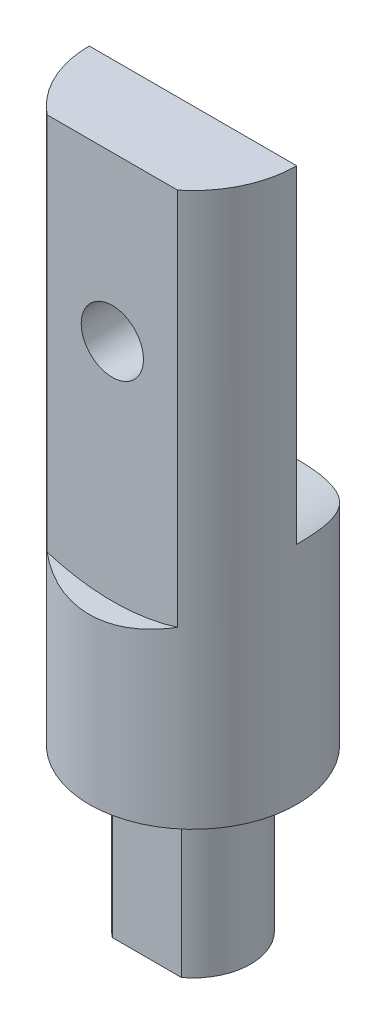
SolidWorks part; units mm, degrees
ref_plane "Front Plane" through (0, 0, 0) normal (0, 0, 1) x (1, 0, 0)
ref_plane "Top Plane" through (0, 0, 0) normal (0, 1, 0) x (1, 0, 0)
ref_plane "Right Plane" through (0, 0, 0) normal (1, 0, 0) x (0, 0, -1)
sketch "Sketch1" plane through (0, 0, 0) normal (0, 1, 0) x (1, 0, 0)
  circle A0 centre (0, 0) radius 4.5
  dimension "D1" = 9
extrude "Boss-Extrude1" add sketch "Sketch1" along normal blind 24 contours A0
sketch "Sketch2" plane through (0, 0, 0) normal (0, -1, 0) x (1, 0, 0)
  circle A0 centre (0, 0) radius 3.9
  dimension "D1" = 7.8
extrude "Boss-Extrude2" add sketch "Sketch2" along normal blind 7
sketch "Sketch4" plane through (0, 0, 0) normal (0, -1, 0) x (1, 0, 0)
  line L0 (-4.6448, 3.9) -> (4.9302, 3.9)
  line L1 (4.9302, 3.9) -> (4.9302, 6.135)
  line L2 (4.9302, 6.135) -> (-4.5584, 6.135)
  line L3 (-4.5584, 6.135) -> (-4.6448, 3.9)
  line L4 (-5.2639, -3.9) -> (5.6645, -3.9)
  line L5 (5.6645, -3.9) -> (5.6645, -4.8677)
  line L6 (5.6645, -4.8677) -> (-5.2639, -4.767)
  line L7 (-5.2639, -4.767) -> (-5.2639, -3.7879)
  circle A0 centre (0, 0) radius 3.9 construction
extrude "Cut-Extrude3" [suppressed] cut sketch "Sketch4" against normal blind 22 contours L2 L3 L0 L1 M2 | L7 L6 L5 L4 M2 | L4 M2
sketch "Sketch5" [suppressed] plane through (0, 0, 0) normal (1, 0, 0) x (0, 0, -1)
  line L0 (3.9, 21.5) -> (-3.9, 21.5) construction
  line L1 (5.8488, 18.5) -> (0.1, 18.5)
  line L2 (5.8488, 18.5) -> (5.8488, 14.5)
  line L3 (5.8488, 14.5) -> (0.1, 14.5)
  line L4 (0.1, 18.5) -> (0.1, 14.5)
  line L5 (-3.9, 21.5) -> (-3.9, 0) construction
  dimension "D1" = 3
  dimension "D2" = 4
  dimension "D3" = 4
extrude "Cut-Extrude4" [suppressed] cut sketch "Sketch5" against normal through all both and the other way through all
sketch "Sketch6" plane through (0, -7, 0) normal (0, -1, 0) x (1, 0, 0)
  circle A0 centre (0, 0) radius 2.5
  dimension "D1" = 5
sketch "Sketch7" plane through (0, -7, 0) normal (0, -1, 0) x (1, 0, 0)
  circle A0 centre (0, 0) radius 3.9
extrude "Cut-Extrude6" cut sketch "Sketch7" against normal blind 7
extrude "Boss-Extrude3" add sketch "Sketch6" against normal blind 7 contours A0
sketch "Sketch8" plane through (0, -7, 0) normal (0, -1, 0) x (1, 0, 0)
  line L1 (-3.2888, -2) -> (3.2888, -2)
  line L2 (-3.2888, -2) -> (-3.2888, 2)
  line L3 (-3.2888, 2) -> (3.2888, 2)
  line L4 (3.2888, -2) -> (3.2888, 2)
  line L5 (-3.2888, -2) -> (3.2888, 2) construction
  line L6 (-3.2888, 2) -> (3.2888, -2) construction
  line L7 (-3.5081, -2.9965) -> (3.5081, -2.9965)
  line L8 (-3.5081, -2.9965) -> (-3.5081, 2.9965)
  line L9 (-3.5081, 2.9965) -> (3.5081, 2.9965)
  line L10 (3.5081, -2.9965) -> (3.5081, 2.9965)
  line L11 (-3.5081, -2.9965) -> (3.5081, 2.9965) construction
  line L12 (-3.5081, 2.9965) -> (3.5081, -2.9965) construction
  point P0 (0, 0)
  point P6 (0, 0)
  dimension "D1" = 4
extrude "Cut-Extrude7" cut sketch "Sketch8" against normal blind 7
sketch "Sketch9" [suppressed] plane through (0, 0, -3.9) normal (0, 0, -1) x (-1, 0, 0)
  line L0 (2.245, 0) -> (-2.245, 0) construction
  circle A0 centre (0, 19) radius 1.5
  dimension "D1" = 3
  dimension "D2" = 19
extrude "Cut-Extrude8" [suppressed] cut sketch "Sketch9" against normal blind 6
sketch "Sketch10" [suppressed] plane through (0, 0, -3.9) normal (0, 0, -1) x (-1, 0, 0)
  circle A0 centre (0, 19) radius 2
  dimension "D1" = 4
extrude "Cut-Extrude13" [suppressed] cut sketch "Sketch10" against normal blind 4
sketch "Sketch11" plane through (0, 24, 0) normal (0, 1, 0) x (1, 0, 0)
  line L0 (-4.5, 0) -> (4.5, 0)
  line L1 (-2.8284, -3.5) -> (2.8284, -3.5)
  arc A0 (4.5, 0) -> (-4.5, 0) centre (0, 0) ccw
  circle A1 centre (0, 0) radius 4.5
  arc A2 (-2.8284, -3.5) -> (2.8284, -3.5) centre (0, 0) ccw
  dimension "D2" = 3.5
  dimension "D1" = 0
extrude "Cut-Extrude14" cut sketch "Sketch11" against normal blind 8
chamfer "Chamfer1" [suppressed] distance 3 angle 55
sketch "Sketch12" plane through (0, 0, 0) normal (0, 0, -1) x (-1, 0, 0)
  circle A0 centre (0, 16.9016) radius 1.35
  dimension "D1" = 2.7
extrude "Cut-Extrude15" cut sketch "Sketch12" against normal through all
sketch "Sketch13" plane through (0, 0, 0) normal (0, 0, -1) x (-1, 0, 0)
  circle A0 centre (0, 16.9016) radius 8.426
extrude "Cut-Extrude16" cut sketch "Sketch13" along normal blind 8
sketch "Sketch14" plane through (0, 0, 3.5) normal (0, 0, 1) x (1, 0, 0)
  circle A0 centre (0, 16.5915) radius 9.4513
extrude "Cut-Extrude17" cut sketch "Sketch14" along normal blind 8
sketch "Sketch15" plane through (0, 0, -2) normal (0, 0, -1) x (-1, 0, 0)
  line L0 (1.5, -7) -> (-1.5, -7) construction
  line L1 (-6.1942, -6) -> (10.0233, -6)
  line L2 (-6.1942, -6) -> (-6.1942, -8.748)
  line L3 (-6.1942, -8.748) -> (10.0233, -8.748)
  line L4 (10.0233, -6) -> (10.0233, -8.748)
  dimension "D1" = 1
extrude "Cut-Extrude18" cut sketch "Sketch15" against normal blind 10
sketch "Sketch16" plane through (0, 0, 0) normal (0, -1, 0) x (1, 0, 0)
  line L0 (-1.5, 2) -> (1.5, 2)
  line L1 (1.5, -2) -> (-1.5, -2)
  circle A0 centre (0, 0) radius 4.1
  arc A1 (-1.5, 2) -> (-1.5, -2) centre (0, 0) ccw
  arc A2 (1.5, -2) -> (1.5, 2) centre (0, 0) ccw
  dimension "D1" = 8.2
sketch "Sketch18" plane through (0, 0, 0) normal (0, -1, 0) x (1, 0, 0)
  line L1 (-6.3758, -1) -> (6.3758, -1)
  line L2 (-6.3758, -1) -> (-6.3758, 1)
  line L3 (-6.3758, 1) -> (6.3758, 1)
  line L4 (6.3758, -1) -> (6.3758, 1)
  line L5 (-6.3758, -1) -> (6.3758, 1) construction
  line L6 (-6.3758, 1) -> (6.3758, -1) construction
  line L7 (-3.3758, -1) -> (3.3758, -1)
  line L8 (-3.3758, -1) -> (-3.3758, 1)
  line L9 (-3.3758, 1) -> (3.3758, 1)
  line L10 (3.3758, -1) -> (3.3758, 1)
  line L11 (-3.3758, -1) -> (3.3758, 1) construction
  line L12 (-3.3758, 1) -> (3.3758, -1) construction
  point P0 (0, 0)
  point P6 (0, 0)
  dimension "D1" = 2
